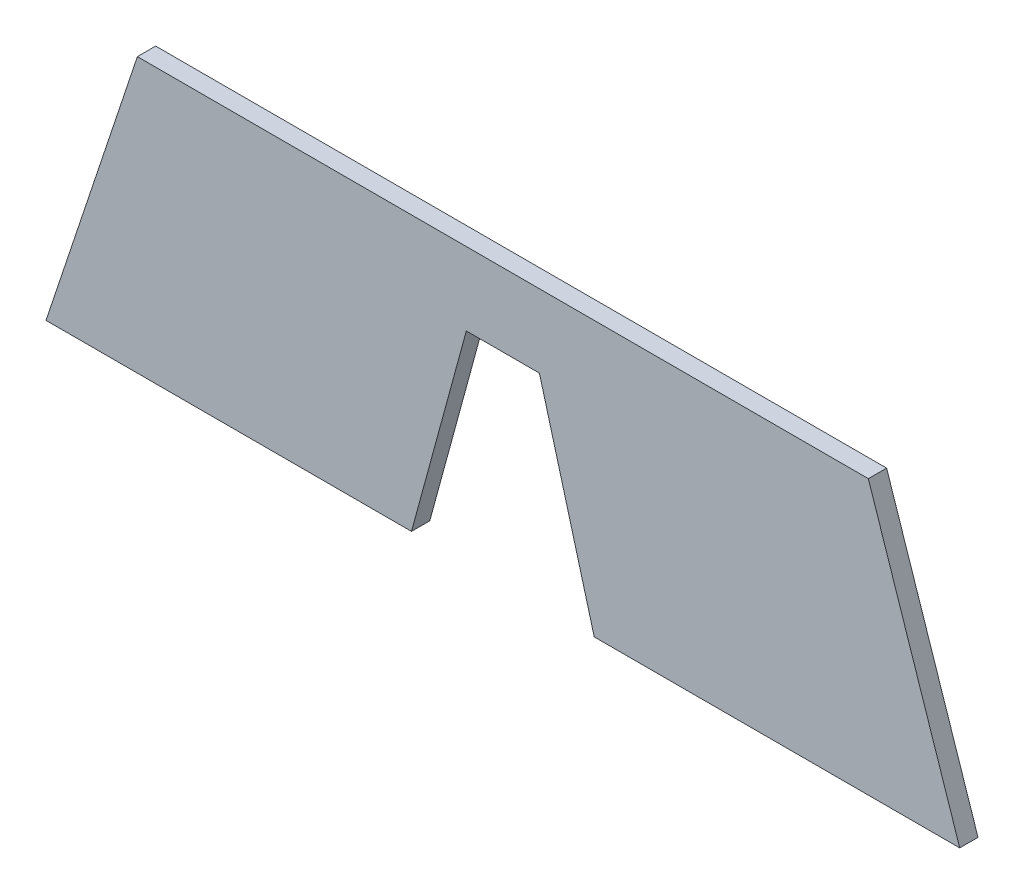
SolidWorks part; units mm, degrees
ref_plane "Front Plane" through (0, 0, 0) normal (0, 0, 1) x (1, 0, 0)
ref_plane "Top Plane" through (0, 0, 0) normal (0, 1, 0) x (1, 0, 0)
ref_plane "Right Plane" through (0, 0, 0) normal (1, 0, 0) x (0, 0, -1)
sketch "Sketch1" plane through (0, 0, 0) normal (0, 0, 1) x (1, 0, 0)
  line L0 (-28.872, 0) -> (51.128, 0)
  line L1 (-28.872, 0) -> (-38.872, -30)
  line L2 (-38.872, -30) -> (61.128, -30)
  line L3 (61.128, -30) -> (51.128, 0)
  line L5 (1.128, -30) -> (7.128, -8)
  line L6 (7.128, -8) -> (15.128, -8)
  line L7 (15.128, -8) -> (21.128, -30)
  point P9 (7.5914, -10.4244)
  point P12 (1.128, -27.9063)
  point P13 (0, 0)
  point P14 (0, 0)
  dimension "D1" = 80
  dimension "D2" = 100
  dimension "D3" = 30
  dimension "D5" = 8
  dimension "D6" = 20
  dimension "D9" = 8
extrude "Boss-Extrude1" add sketch "Sketch1" along normal blind 2 contours L6 L7 L2 L3 L0 L1 L5
